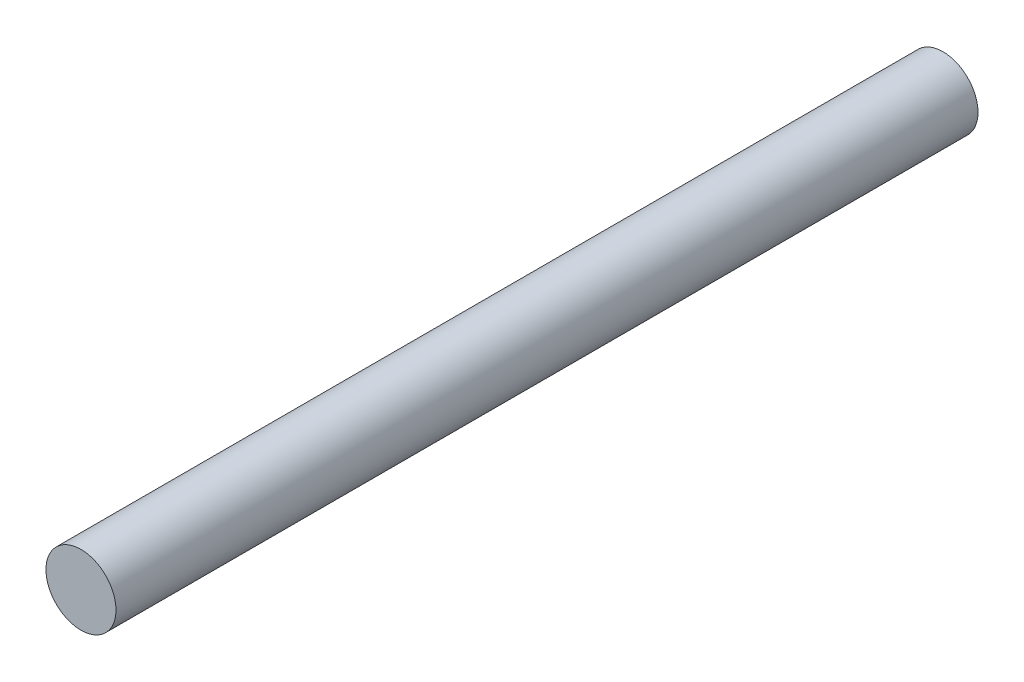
SolidWorks part; units mm, degrees
ref_plane "Plan de face" through (0, 0, 0) normal (0, 0, 1) x (1, 0, 0)
ref_plane "Plan de dessus" through (0, 0, 0) normal (0, 1, 0) x (1, 0, 0)
ref_plane "Plan de droite" through (0, 0, 0) normal (1, 0, 0) x (0, 0, -1)
sketch "Esquisse1" plane through (0, 0, 0) normal (0, 0, 1) x (1, 0, 0)
  circle A0 centre (-9.6549, 2.3077) radius 3.25
  dimension "D1" = 6.5
extrude "Boss.-Extru.1" add sketch "Esquisse1" along normal blind 80
